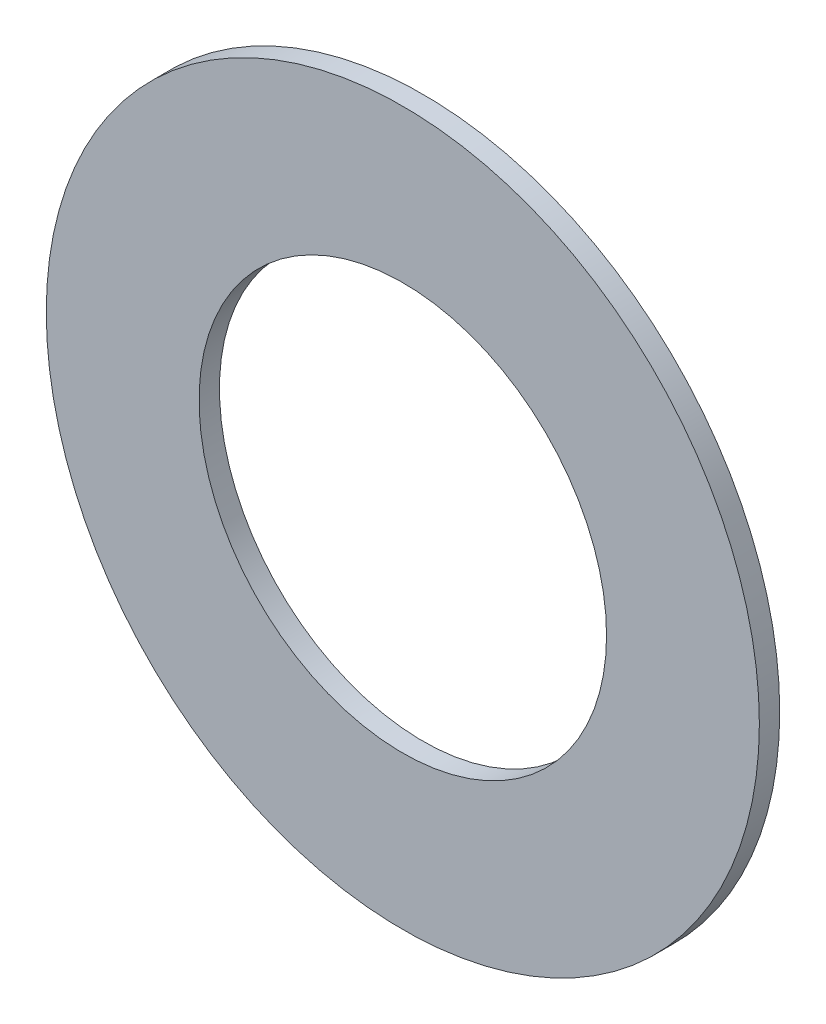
SolidWorks part; units mm, degrees
ref_plane "Face" through (0, 0, 0) normal (0, 0, 1) x (1, 0, 0)
ref_plane "Dessus" through (0, 0, 0) normal (0, 1, 0) x (1, 0, 0)
ref_plane "Droite" through (0, 0, 0) normal (1, 0, 0) x (0, 0, -1)
sketch "Esquisse1" plane through (0, 0, 0) normal (0, 0, 1) x (1, 0, 0)
  circle A0 centre (0, 0) radius 17.5
  circle A1 centre (0, 0) radius 10
  dimension "D1" = 20
  dimension "D2" = 35
extrude "Base-Extrusion" add sketch "Esquisse1" against normal blind 1
